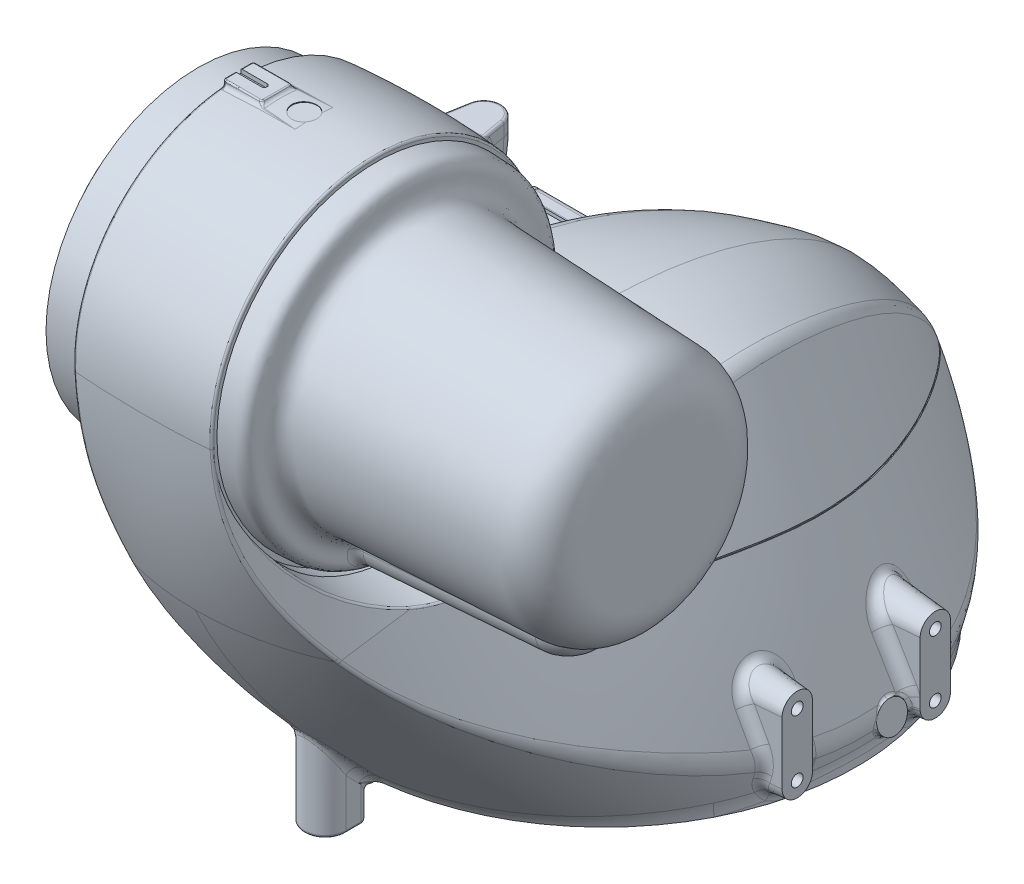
SolidWorks part; units mm, degrees
ref_plane "前视基准面" through (0, 0, 0) normal (0, 0, 1) x (1, 0, 0)
ref_plane "上视基准面" through (0, 0, 0) normal (0, 1, 0) x (1, 0, 0)
ref_plane "右视基准面" through (0, 0, 0) normal (1, 0, 0) x (0, 0, -1)
imported_body "输入1"
sketch "草图1" plane through (-190, 0, 0) normal (-1, 0, 0) x (0, 0, 1)
  line L0 (-140, 20) -> (-22.5144, 20) construction
  line L1 (-140, 20) -> (-22.5144, 20) construction
  line L2 (-130, 105) -> (-60, 105)
  line L4 (-60, 105) -> (-60, 175.5125)
  line L5 (-130, 25) -> (-130, 100.5)
  line L6 (-130, 105) -> (-130, 174.7319)
  line L7 (-130, 174.7319) -> (-60, 175.5125)
  line L8 (-130, 25) -> (-130, 100.5) construction
  line L9 (-60, 25) -> (-60, 100.5) construction
  line L11 (-140, 105) -> (-22.5144, 105) construction
  dimension "D1" = 85
  dimension "D2" = 15
  dimension "D3" = 70
extrude "切除-拉伸1" cut sketch "草图1" against normal blind 60
sketch "草图2" plane through (0, 105, 0) normal (0, 1, 0) x (1, 0, 0)
  line L2 (-190, 120) -> (-138.0357, 120)
  line L3 (-190, 120) -> (-138.0357, 120) construction
  line L4 (-152, 120) -> (-152, 70) construction
  line L5 (-182, 130) -> (-182, 60)
  line L6 (-182, 120) -> (-182, 70) construction
  line L7 (-190, 70) -> (-138.0357, 70) construction
  line L8 (-167, 120) -> (-167, 70) construction
  line L10 (-182, 130) -> (-182, 60) construction
  line L11 (-152, 130) -> (-152, 60) construction
  line L12 (-167, 130) -> (-167, 60) construction
  circle A2 centre (-182, 70) radius 2.5
  circle A3 centre (-182, 120) radius 2.5
  circle A4 centre (-152, 120) radius 2.5
  circle A5 centre (-152, 70) radius 2.5
  dimension "D6" = 5
  dimension "D7" = 5
  dimension "D9" = 5
  dimension "D11" = 5
  dimension "D1" = 25
  dimension "D2" = 8
  dimension "D3" = 30
  dimension "D4" = 50
  dimension "D5" = 15
extrude "切除-拉伸2" cut sketch "草图2" against normal blind 12
